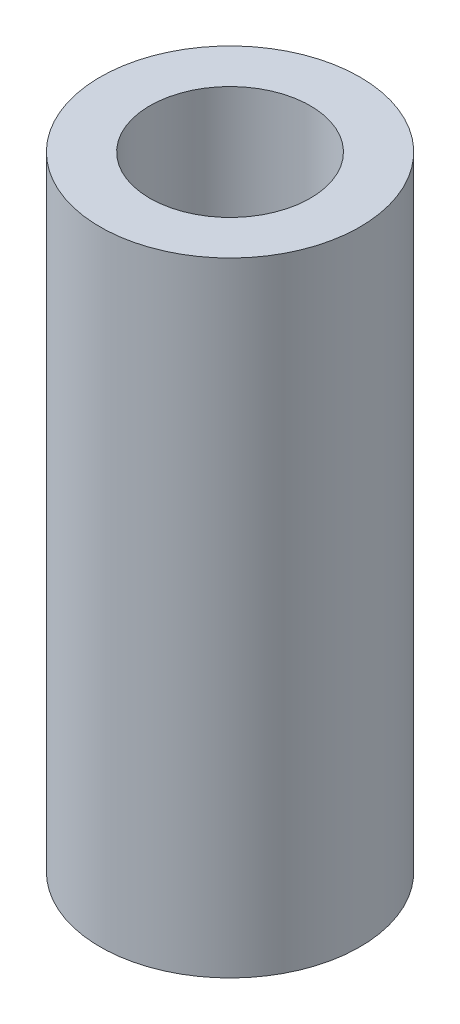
SolidWorks part; units mm, degrees
ref_plane "Front Plane" through (0, 0, 0) normal (0, 0, 1) x (1, 0, 0)
ref_plane "Top Plane" through (0, 0, 0) normal (0, 1, 0) x (1, 0, 0)
ref_plane "Right Plane" through (0, 0, 0) normal (1, 0, 0) x (0, 0, -1)
sketch "Sketch1" plane through (0, 0, 0) normal (0, 1, 0) x (1, 0, 0)
  circle A0 centre (0, 0) radius 7.9375
  dimension "D1" = 15.875
extrude "Extrude1" add sketch "Sketch1" along normal blind 38.1
sketch "Sketch2" plane through (0, 38.1, 0) normal (0, 1, 0) x (-1, 0, 0)
  circle A0 centre (0, 0) radius 4.9022
  dimension "D1" = 9.8044
extrude "cavity" cut sketch "Sketch2" against normal blind 31.75
hole_wizard "CSK for #8 Flat Head Machine Screw1" positions "Sketch4" profile "Sketch3" countersink size "#8" standard "Ansi Inch"
sketch "Sketch4" plane through (0, 6.35, 0) normal (0, 1, 0) x (-1, 0, 0)
  point P0 (0, 0)
sketch "Sketch3" plane through (0, 6.35, 0) normal (1, 0, 0) x (0, 0, 1)
  line L0 (0, 0) -> (0, 6.35)
  line L1 (0, 6.35) -> (2.2479, 6.35)
  line L2 (2.2479, 6.35) -> (2.2479, 2.2645)
  line L3 (2.2479, 2.2645) -> (4.2164, 0)
  line L5 (4.2164, 0) -> (0, 0)
  line L6 (-2.2479, 2.2645) -> (-4.2164, 0) construction
  line L11 (0, -6.35) -> (0, 107.95) construction
  dimension "Thru Hole Dia." = 4.4958
  dimension "Thru Hole Depth" = 6.35
  dimension "Near C'Sink Dia." = 8.4328
  dimension "Near C'Sink Angle" = 82
